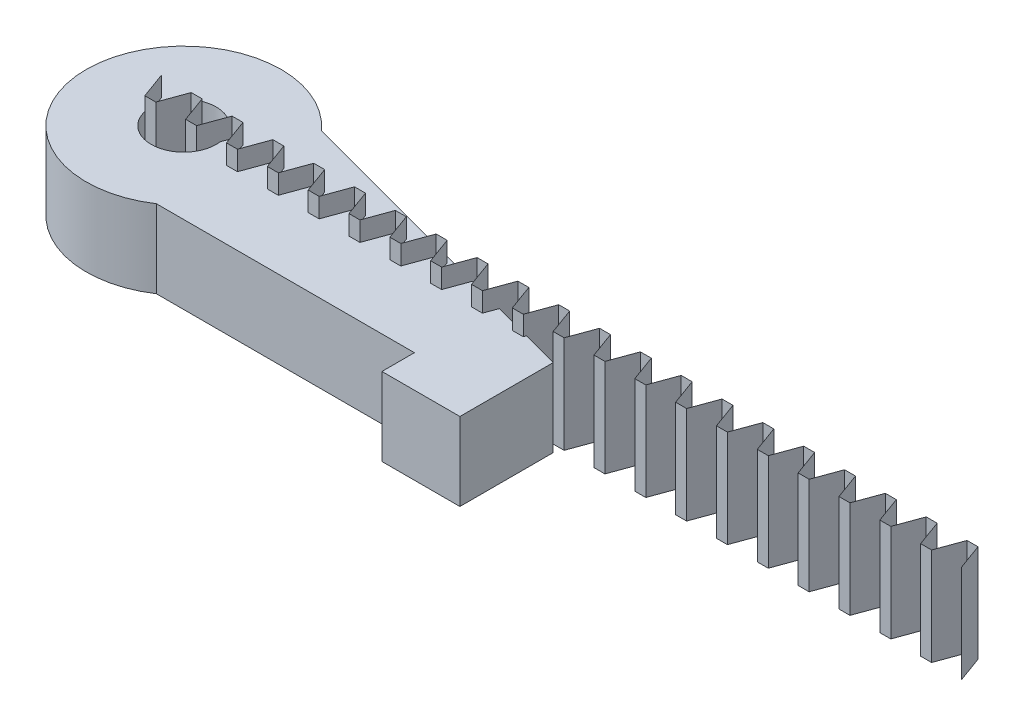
SolidWorks part; units mm, degrees
other "Detailelement1"
ref_plane "Vorne" through (0, 0, 0) normal (0, 0, 1) x (1, 0, 0)
ref_plane "Oben" through (0, 0, 0) normal (0, 1, 0) x (1, 0, 0)
ref_plane "Rechts" through (0, 0, 0) normal (1, 0, 0) x (0, 0, -1)
sketch "Skizze1" plane through (0, 0, 0) normal (0, 1, 0) x (1, 0, 0)
  line L0 (8.2916, -12.5) -> (48, -12.5)
  line L1 (48, -12.5) -> (48, -17.5)
  line L2 (48, -17.5) -> (60, -17.5)
  line L3 (60, -17.5) -> (60, -3.136)
  line L4 (60, -3.136) -> (11.2443, 9.9281)
  circle A0 centre (0, 0) radius 5
  arc A1 (11.2443, 9.9281) -> (8.2916, -12.5) centre (0, 0) ccw
  circle A2 centre (0, 0) radius 12.5 construction
  dimension "D1" = 10
  dimension "D2" = 30
  dimension "D3" = 25
  dimension "D4" = 12
  dimension "D5" = 60
  dimension "D6" = 15
  dimension "D7" = 5
extrude "Linear austragen1" add sketch "Skizze1" along normal blind 12
sketch "Skizze2" plane through (0, 0, 0) normal (0, 1, 0) x (1, 0, 0)
  line L0 (-5.4403, 2) -> (-3.9844, -2)
  line L1 (-3.9844, -2) -> (-2.2987, -2)
  line L2 (-2.2987, -2) -> (-0.8429, 2)
  line L3 (-0.8429, 2) -> (0.8429, 2)
  line L4 (0.8429, 2) -> (2.2987, -2)
  line L5 (0, 16.7107) -> (0, 20.7403) construction
  line L6 (-5.8865, 0) -> (3.0402, 0) construction
  line L7 (2.2987, -2) -> (3.9844, -2)
  line L8 (3.9844, -2) -> (5.4403, 2)
  line L9 (5.4403, 2) -> (7.126, 2)
  line L10 (7.126, 2) -> (8.5819, -2)
  line L11 (8.5819, -2) -> (10.2676, -2)
  line L12 (10.2676, -2) -> (11.7235, 2)
  line L13 (11.7235, 2) -> (13.4092, 2)
  line L14 (13.4092, 2) -> (14.8651, -2)
  line L15 (14.8651, -2) -> (16.5508, -2)
  line L16 (16.5508, -2) -> (18.0067, 2)
  line L17 (18.0067, 2) -> (19.6924, 2)
  line L18 (19.6924, 2) -> (21.1483, -2)
  line L19 (21.1483, -2) -> (22.834, -2)
  line L20 (22.834, -2) -> (24.2899, 2)
  line L21 (24.2899, 2) -> (25.9756, 2)
  line L22 (25.9756, 2) -> (27.4315, -2)
  line L23 (27.4315, -2) -> (29.1172, -2)
  line L24 (29.1172, -2) -> (30.5731, 2)
  line L25 (30.5731, 2) -> (32.2588, 2)
  line L26 (32.2588, 2) -> (33.7147, -2)
  line L27 (33.7147, -2) -> (35.4004, -2)
  line L28 (35.4004, -2) -> (36.8563, 2)
  line L29 (36.8563, 2) -> (38.542, 2)
  line L30 (38.542, 2) -> (39.9978, -2)
  line L31 (39.9978, -2) -> (41.6836, -2)
  line L32 (41.6836, -2) -> (43.1394, 2)
  line L33 (43.1394, 2) -> (44.8252, 2)
  line L34 (44.8252, 2) -> (46.281, -2)
  line L35 (46.281, -2) -> (47.9667, -2)
  line L36 (47.9667, -2) -> (49.4226, 2)
  line L37 (49.4226, 2) -> (51.1083, 2)
  line L38 (51.1083, 2) -> (52.5642, -2)
  line L39 (52.5642, -2) -> (54.2499, -2)
  line L40 (54.2499, -2) -> (55.7058, 2)
  line L41 (55.7058, 2) -> (57.3915, 2)
  line L42 (57.3915, 2) -> (58.8474, -2)
  line L43 (58.8474, -2) -> (60.5331, -2)
  line L44 (60.5331, -2) -> (61.989, 2)
  line L45 (61.989, 2) -> (63.6747, 2)
  line L46 (63.6747, 2) -> (65.1306, -2)
  line L47 (65.1306, -2) -> (66.8163, -2)
  line L48 (66.8163, -2) -> (68.2722, 2)
  line L49 (68.2722, 2) -> (69.9579, 2)
  line L50 (69.9579, 2) -> (71.4138, -2)
  line L51 (71.4138, -2) -> (73.0995, -2)
  line L52 (73.0995, -2) -> (74.5554, 2)
  line L53 (74.5554, 2) -> (76.2411, 2)
  line L54 (76.2411, 2) -> (77.697, -2)
  line L55 (77.697, -2) -> (79.3827, -2)
  line L56 (79.3827, -2) -> (80.8386, 2)
  line L57 (80.8386, 2) -> (82.5243, 2)
  line L58 (82.5243, 2) -> (83.9801, -2)
  line L59 (83.9801, -2) -> (85.6659, -2)
  line L60 (85.6659, -2) -> (87.1217, 2)
  line L61 (87.1217, 2) -> (88.8075, 2)
  line L62 (88.8075, 2) -> (90.2633, -2)
  line L63 (90.2633, -2) -> (91.949, -2)
  line L64 (91.949, -2) -> (93.4049, 2)
  line L65 (93.4049, 2) -> (95.0906, 2)
  line L66 (95.0906, 2) -> (96.5465, -2)
  line L67 (96.5465, -2) -> (98.2322, -2)
  line L68 (98.2322, -2) -> (99.6881, 2)
  line L69 (99.6881, 2) -> (101.3738, 2)
  line L70 (101.3738, 2) -> (102.8297, -2)
  line L71 (102.8297, -2) -> (104.5154, -2)
  line L72 (104.5154, -2) -> (105.9713, 2)
  line L73 (105.9713, 2) -> (107.657, 2)
  line L74 (107.657, 2) -> (109.1129, -2)
  line L75 (109.1129, -2) -> (110.7986, -2)
  line L76 (110.7986, -2) -> (112.2545, 2)
  line L77 (112.2545, 2) -> (113.9402, 2)
  line L78 (113.9402, 2) -> (115.3961, -2)
  line L79 (115.3961, -2) -> (117.0818, -2)
  line L80 (117.0818, -2) -> (118.5377, 2)
  line L81 (118.5377, 2) -> (120.2234, 2)
  line L82 (120.2234, 2) -> (121.6793, -2)
  dimension "D1" = 40
  dimension "D2" = 6.2832
  dimension "D3" = 4
surface "Oberfläche-Linear austragen1" sketch "Skizze2" parameters "D1"=15
